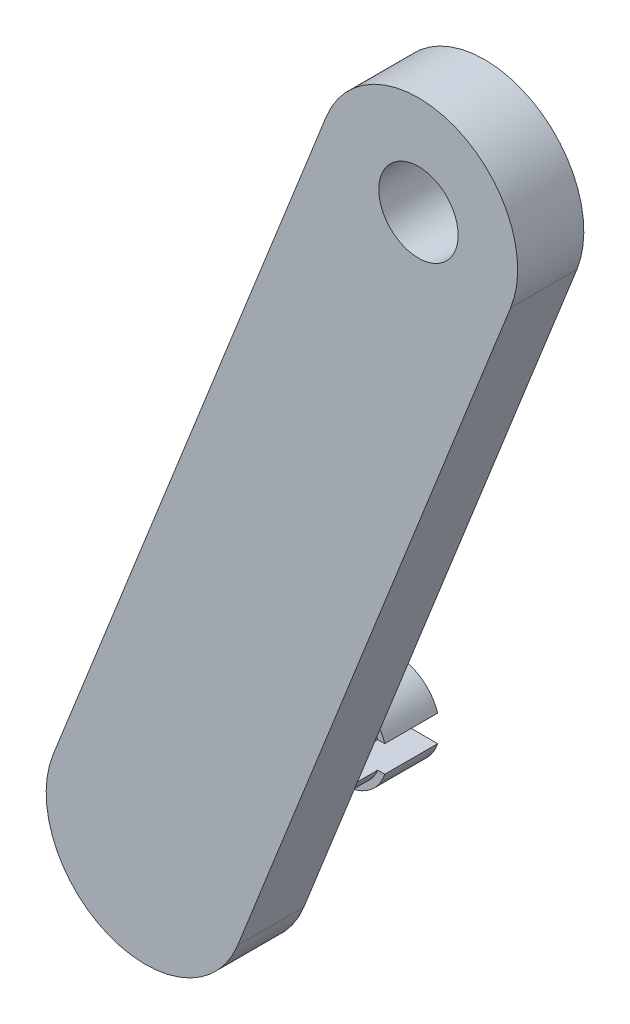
SolidWorks part; units mm, degrees
ref_plane "Plan de face" through (0, 0, 0) normal (0, 0, 1) x (1, 0, 0)
ref_plane "Plan de dessus" through (0, 0, 0) normal (0, 1, 0) x (1, 0, 0)
ref_plane "Plan de droite" through (0, 0, 0) normal (1, 0, 0) x (0, 0, -1)
sketch "Esquisse1" plane through (0, 0, 0) normal (0, 0, 1) x (1, 0, 0)
  line L0 (-64, -4) -> (-84.6394, -56.0578) construction
  line L1 (-57.028, -6.7642) -> (-77.6674, -58.822)
  line L2 (-70.972, -1.2358) -> (-91.6115, -53.2936)
  arc A0 (-57.028, -6.7642) -> (-70.972, -1.2358) centre (-64, -4) ccw
  arc A1 (-91.6115, -53.2936) -> (-77.6674, -58.822) centre (-84.6394, -56.0578) ccw
  point P4 (-74.3197, -30.0289)
  dimension "D1" = 15
extrude "Boss.-Extru.1" add sketch "Esquisse1" along normal blind 5
sketch "Esquisse2" plane through (0, 0, 5) normal (0, 0, 1) x (1, 0, 0)
  circle A0 centre (-84.6394, -56.0578) radius 2.75
  dimension "D1" = 5.5
extrude "Boss.-Extru.2" add sketch "Esquisse2" against normal blind 15
sketch "Esquisse4" plane through (0, 0, -10) normal (0, 0, -1) x (-1, 0, 0)
  circle A0 centre (84.6394, -56.0578) radius 3.25
  dimension "D1" = 6.5
extrude "Boss.-Extru.3" add sketch "Esquisse4" along normal blind 4
sketch "Esquisse5" plane through (0, 0, -14) normal (0, 0, -1) x (-1, 0, 0)
  line L1 (79.6394, -55.0578) -> (89.6394, -55.0578)
  line L2 (79.6394, -55.0578) -> (79.6394, -57.0578)
  line L3 (79.6394, -57.0578) -> (89.6394, -57.0578)
  line L4 (89.6394, -55.0578) -> (89.6394, -57.0578)
  dimension "D1" = 1
  dimension "D2" = 1
  dimension "D3" = 5
  dimension "D4" = 10
extrude "Enlèv. mat.-Extru.2" cut sketch "Esquisse5" against normal blind 14
sketch "Esquisse6" plane through (0, 0, 5) normal (0, 0, 1) x (1, 0, 0)
  circle A0 centre (-64, -4) radius 3
  dimension "D1" = 6
extrude "Enlèv. mat.-Extru.3" cut sketch "Esquisse6" against normal blind 14
